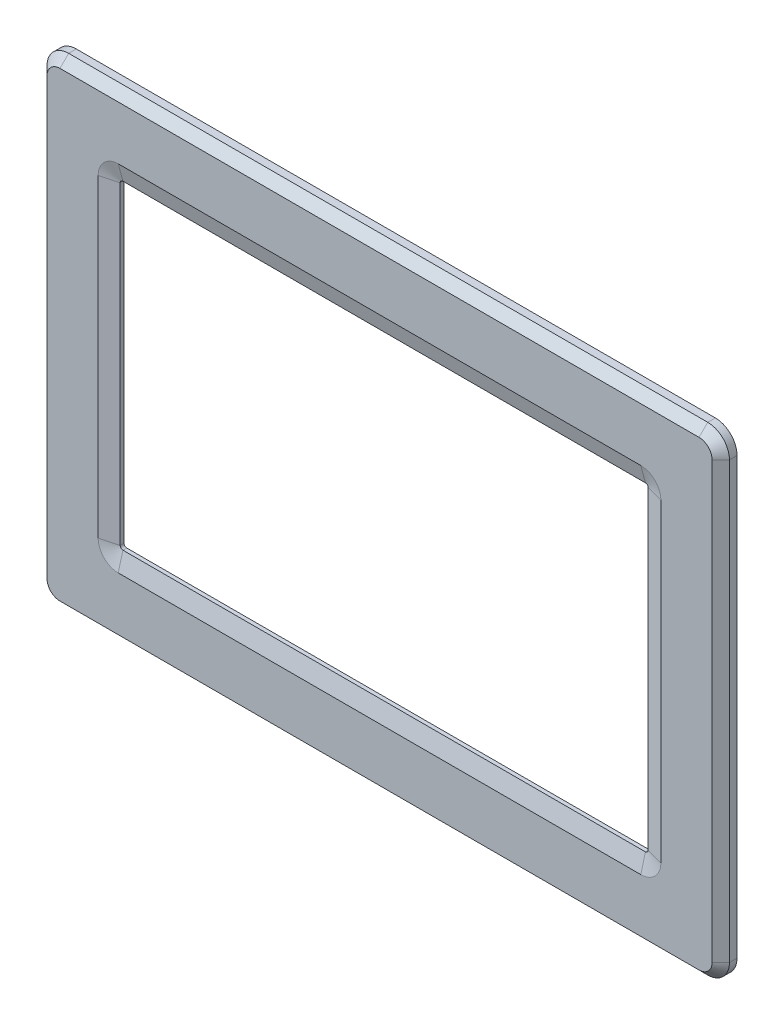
SolidWorks part; units mm, degrees
ref_plane "Front" through (0, 0, 0) normal (0, 0, 1) x (1, 0, 0)
ref_plane "Top" through (0, 0, 0) normal (0, 1, 0) x (1, 0, 0)
ref_plane "Right" through (0, 0, 0) normal (1, 0, 0) x (0, 0, -1)
sketch "Sketch1" plane through (0, 0, 0) normal (0, 0, 1) x (1, 0, 0)
  line L0 (0, 70.01) -> (0, -70.01) construction
  line L1 (-99.81, 70.01) -> (99.81, 70.01)
  line L2 (-99.81, 70.01) -> (-99.81, -70.01)
  line L3 (-99.81, -70.01) -> (99.81, -70.01)
  line L4 (99.81, 70.01) -> (99.81, -70.01)
  line L5 (83.3, -53.5) -> (83.3, 53.5) construction
  line L6 (83.3, 53.5) -> (-83.3, 53.5) construction
  dimension "D1" = 16.51
  dimension "D2" = 16.51
extrude "Extrude1" add sketch "Sketch1" along normal blind 4.7625
sketch "Sketch2" plane through (0, 0, 4.7625) normal (0, 0, 1) x (1, 0, 0)
  line L8 (77.216, -46.736) -> (77.216, 46.736)
  line L9 (-77.216, -46.736) -> (77.216, -46.736)
  line L10 (-77.216, 46.736) -> (-77.216, -46.736)
  line L11 (77.216, 46.736) -> (-77.216, 46.736)
  line L12 (77.216, -45.941) -> (77.216, 45.941)
  line L13 (-76.421, -46.736) -> (76.421, -46.736)
  line L14 (-77.216, 45.941) -> (-77.216, -45.941)
  line L15 (76.421, 46.736) -> (-76.421, 46.736)
  arc A0 (-76.421, 46.736) -> (-77.216, 45.941) centre (-76.421, 45.941) ccw
  arc A1 (77.216, 45.941) -> (76.421, 46.736) centre (76.421, 45.941) ccw
  arc A2 (76.421, -46.736) -> (77.216, -45.941) centre (76.421, -45.941) ccw
  arc A3 (-77.216, -45.941) -> (-76.421, -46.736) centre (-76.421, -45.941) ccw
  dimension "D2" = 0.795
  dimension "D1" = 1.016
extrude "Cut-Extrude1" cut sketch "Sketch2" against normal through all
sketch "Sketch3" plane through (0, 0, 0) normal (0, 0, -1) x (-1, 0, 0)
  line L8 (83.554, 53.754) -> (83.554, -53.5)
  line L9 (-83.554, 53.754) -> (83.554, 53.754)
  line L10 (-83.554, -53.754) -> (-83.554, 53.754)
  line L11 (22.9, -53.754) -> (-83.554, -53.754)
  line L12 (83.554, 53.754) -> (83.554, -53.754)
  line L13 (-83.554, 53.754) -> (83.554, 53.754)
  line L14 (-83.554, -53.754) -> (-83.554, 53.754)
  line L15 (83.554, -53.754) -> (-83.554, -53.754)
  dimension "D1" = 0.254
extrude "Cut-Extrude2" cut sketch "Sketch3" against normal blind 2.286
sketch "Sketch10" plane through (0, 0, 0) normal (0, 0, -1) x (-1, 0, 0)
  line L0 (81.649, 12.7) -> (81.649, -12.7)
  line L2 (84.824, 9.525) -> (84.824, -9.525)
  line L3 (0, 0) -> (81.649, 0) construction
  line L4 (83.554, -53.754) -> (83.554, 53.754) construction
  line L5 (0, 0) -> (0, -20.3255) construction
  line L6 (-84.824, 9.525) -> (-84.824, -9.525)
  line L7 (-81.649, 12.7) -> (-81.649, -12.7)
  arc A0 (81.649, 12.7) -> (84.824, 9.525) centre (81.649, 9.525) cw
  arc A1 (84.824, -9.525) -> (81.649, -12.7) centre (81.649, -9.525) cw
  arc A2 (-84.824, -9.525) -> (-81.649, -12.7) centre (-81.649, -9.525) ccw
  arc A3 (-81.649, 12.7) -> (-84.824, 9.525) centre (-81.649, 9.525) ccw
  dimension "D1" = 3.175
  dimension "D2" = 25.4
  dimension "D3" = 1.27
extrude "Extrude6" cut sketch "Sketch10" against normal up to surface (2.286 mm away)
sketch "Sketch9" plane through (0, 0, 0) normal (0, 0, -1) x (-1, 0, 0)
  line L0 (0, 0) -> (-21.889, 0) construction
  line L1 (0, 0) -> (0, 20.7425) construction
  line L2 (-83.554, 53.754) -> (-81.9665, 53.754)
  line L3 (83.554, 53.754) -> (-83.554, 53.754) construction
  line L4 (83.554, 53.754) -> (81.9665, 53.754)
  line L5 (83.554, -53.754) -> (81.9665, -53.754)
  line L6 (-83.554, -53.754) -> (-81.9665, -53.754)
  arc A0 (-81.9665, 53.754) -> (-83.554, 53.754) centre (-82.7603, 53.754) ccw
  arc A1 (81.9665, 53.754) -> (83.554, 53.754) centre (82.7603, 53.754) cw
  arc A2 (81.9665, -53.754) -> (83.554, -53.754) centre (82.7603, -53.754) ccw
  arc A3 (-81.9665, -53.754) -> (-83.554, -53.754) centre (-82.7603, -53.754) cw
  dimension "D1" = 1.5875
extrude "Extrude5" cut sketch "Sketch9" against normal up to surface (2.286 mm away)
chamfer "Chamfer1" distance 5.08 angle 15 8 edges at (0, -46.736, 4.7625) (76.9831, -46.5031, 4.7625) (-76.9831, -46.5031, 4.7625) (77.216, 0, 4.7625) (-77.216, 0, 4.7625) (76.9831, 46.5031, 4.7625) (-76.9831, 46.5031, 4.7625) (0, 46.736, 4.7625)
fillet "Fillet1" radius 6.35 4 edges at (-99.81, -70.01, 2.3813) (99.81, -70.01, 2.3813) (99.81, 70.01, 2.3813) (-99.81, 70.01, 2.3813)
chamfer "Chamfer2" distance 2.54 angle 45 8 edges at (0, -70.01, 4.7625) (97.9501, -68.1501, 4.7625) (-97.9501, -68.1501, 4.7625) (99.81, 0, 4.7625) (-99.81, 0, 4.7625) (97.9501, 68.1501, 4.7625) (-97.9501, 68.1501, 4.7625) (0, 70.01, 4.7625)
sketch "Sketch4" plane through (0, 0, 0) normal (0, 0, -1) x (-1, 0, 0)
  line L12 (98.0574, -63.373) -> (98.0574, 63.373)
  line L13 (93.173, 68.2574) -> (-93.173, 68.2574)
  line L14 (-98.0574, 63.373) -> (-98.0574, -63.373)
  line L15 (-93.173, -68.2574) -> (93.173, -68.2574)
  line L16 (93.968, -63.66) -> (93.968, 63.66)
  line L17 (-93.46, -64.168) -> (93.46, -64.168)
  line L18 (-93.968, 63.66) -> (-93.968, -63.66)
  line L19 (93.46, 64.168) -> (-93.46, 64.168)
  line L20 (93.968, -63.373) -> (93.968, 63.373)
  line L21 (-93.173, -64.168) -> (93.173, -64.168)
  line L22 (-93.968, 63.373) -> (-93.968, -63.373)
  line L23 (93.173, 64.168) -> (-93.173, 64.168)
  arc A8 (-93.173, 64.168) -> (-93.968, 63.373) centre (-93.173, 63.373) ccw
  arc A9 (93.968, 63.373) -> (93.173, 64.168) centre (93.173, 63.373) ccw
  arc A10 (93.173, -64.168) -> (93.968, -63.373) centre (93.173, -63.373) ccw
  arc A11 (-93.968, -63.373) -> (-93.173, -64.168) centre (-93.173, -63.373) ccw
  arc A12 (98.0574, 63.373) -> (93.173, 68.2574) centre (93.173, 63.373) ccw
  arc A13 (-93.173, 68.2574) -> (-98.0574, 63.373) centre (-93.173, 63.373) ccw
  arc A14 (-98.0574, -63.373) -> (-93.173, -68.2574) centre (-93.173, -63.373) ccw
  arc A15 (93.173, -68.2574) -> (98.0574, -63.373) centre (93.173, -63.373) ccw
  arc A20 (-93.968, -63.66) -> (-93.46, -64.168) centre (-93.46, -63.66) ccw
  arc A22 (-93.46, 64.168) -> (-93.968, 63.66) centre (-93.46, 63.66) ccw
  arc A24 (93.968, 63.66) -> (93.46, 64.168) centre (93.46, 63.66) ccw
  arc A26 (93.46, -64.168) -> (93.968, -63.66) centre (93.46, -63.66) ccw
  dimension "D1" = 5.842
  dimension "D3" = 4.0894
extrude "Extrude2" cut sketch "Sketch4" against normal blind 0.762
sketch "Sketch5" plane through (0, 0, 0) normal (0, 0, -1) x (-1, 0, 0)
  line L6 (83.058, 55.532) -> (83.058, 59.596)
  line L7 (-83.058, 59.596) -> (-83.058, 55.532)
  line L8 (79.629, 63.025) -> (-79.629, 63.025)
  line L9 (83.058, 54.4525) -> (83.058, 59.596)
  line L10 (-83.058, 59.596) -> (-83.058, 54.4525)
  line L11 (79.629, 63.025) -> (-79.629, 63.025)
  line L13 (81.4705, 52.865) -> (-81.4705, 52.865)
  line L14 (0, 0) -> (-18.1366, 0) construction
  line L15 (81.4705, -52.865) -> (-81.4705, -52.865)
  line L16 (79.629, -63.025) -> (-79.629, -63.025)
  line L17 (-83.058, -59.596) -> (-83.058, -54.4525)
  line L18 (83.058, -54.4525) -> (83.058, -59.596)
  arc A4 (83.058, 59.596) -> (79.629, 63.025) centre (79.629, 59.596) ccw
  arc A5 (-79.629, 63.025) -> (-83.058, 59.596) centre (-79.629, 59.596) ccw
  arc A6 (83.058, 59.596) -> (79.629, 63.025) centre (79.629, 59.596) ccw
  arc A7 (-79.629, 63.025) -> (-83.058, 59.596) centre (-79.629, 59.596) ccw
  arc A8 (-83.058, 54.4525) -> (-81.4705, 52.865) centre (-81.4705, 54.4525) ccw
  arc A9 (83.058, 54.4525) -> (81.4705, 52.865) centre (81.4705, 54.4525) cw
  arc A10 (83.058, -54.4525) -> (81.4705, -52.865) centre (81.4705, -54.4525) ccw
  arc A11 (-83.058, -54.4525) -> (-81.4705, -52.865) centre (-81.4705, -54.4525) cw
  arc A12 (-79.629, -63.025) -> (-83.058, -59.596) centre (-79.629, -59.596) cw
  arc A13 (83.058, -59.596) -> (79.629, -63.025) centre (79.629, -59.596) cw
  dimension "D2" = 1.5875
  dimension "D3" = 10.16
  dimension "D1" = 0.254
extrude "Extrude3" cut sketch "Sketch5" against normal blind 1.016
hole_wizard "#2-56 Tapped Hole1" positions "Sketch7" profile "Sketch6" tap size "#2-56" standard "Ansi Inch"
sketch "Sketch7" plane through (0, 0, 1.016) normal (0, 0, -1) x (-1, 0, 0)
  point P3 (-75.4416, 59.596)
  point P9 (0, 59.596)
  point P15 (75.4416, 59.596)
  point P18 (75.4416, -59.596)
  point P24 (0, -59.596)
  point P30 (-75.4416, -59.596)
sketch "Sketch6" plane through (75.4416, 59.596, 1.016) normal (1, 0, 0) x (0, 1, 0)
  line L0 (0, 0) -> (0, 3.302)
  line L1 (0, 3.302) -> (0.889, 3.302)
  line L2 (0.889, 3.302) -> (0.889, 0)
  line L5 (0.889, 0) -> (0, 0)
  line L10 (0, 3.302) -> (-0.889, 3.302) construction
  line L11 (0, -6.35) -> (0, 107.95) construction
  dimension "Tap Drill Dia." = 1.778
  dimension "Tap Drill Depth" = 3.302
  dimension "Drill Angle" = 180
sketch "Sketch8" plane through (0, 0, 2.286) normal (0, 0, -1) x (-1, 0, 0)
  line L9 (76.421, 51.689) -> (-76.421, 51.689)
  line L10 (-82.169, 45.941) -> (-82.169, -45.941)
  line L11 (-76.421, -51.689) -> (76.421, -51.689)
  line L12 (82.169, -45.941) -> (82.169, 45.941)
  line L13 (76.421, 48.387) -> (-76.421, 48.387)
  line L14 (78.867, -45.941) -> (78.867, 45.941)
  line L15 (-76.421, -48.387) -> (76.421, -48.387)
  line L16 (-78.867, 45.941) -> (-78.867, -45.941)
  line L17 (76.421, 48.387) -> (-76.421, 48.387)
  line L18 (78.867, -45.941) -> (78.867, 45.941)
  line L19 (-76.421, -48.387) -> (76.421, -48.387)
  line L20 (-78.867, 45.941) -> (-78.867, -45.941)
  arc A4 (-76.421, 51.689) -> (-82.169, 45.941) centre (-76.421, 45.941) ccw
  arc A5 (-82.169, -45.941) -> (-76.421, -51.689) centre (-76.421, -45.941) ccw
  arc A6 (76.421, -51.689) -> (82.169, -45.941) centre (76.421, -45.941) ccw
  arc A7 (82.169, 45.941) -> (76.421, 51.689) centre (76.421, 45.941) ccw
  arc A8 (78.867, 45.941) -> (76.421, 48.387) centre (76.421, 45.941) ccw
  arc A9 (76.421, -48.387) -> (78.867, -45.941) centre (76.421, -45.941) ccw
  arc A10 (-78.867, -45.941) -> (-76.421, -48.387) centre (-76.421, -45.941) ccw
  arc A11 (-76.421, 48.387) -> (-78.867, 45.941) centre (-76.421, 45.941) ccw
  arc A12 (78.867, 45.941) -> (76.421, 48.387) centre (76.421, 45.941) ccw
  arc A13 (76.421, -48.387) -> (78.867, -45.941) centre (76.421, -45.941) ccw
  arc A14 (-78.867, -45.941) -> (-76.421, -48.387) centre (-76.421, -45.941) ccw
  arc A15 (-76.421, 48.387) -> (-78.867, 45.941) centre (-76.421, 45.941) ccw
  dimension "D1" = 1.651
  dimension "D2" = 3.302
extrude "Extrude4" cut sketch "Sketch8" against normal blind 1.016
sketch "Sketch11" plane through (0, 0, 1.016) normal (0, 0, -1) x (-1, 0, 0)
  line L0 (0, 0) -> (0, 22.5074) construction
  line L1 (0, 0) -> (-19.0069, 0) construction
  line L2 (-75.4416, 59.596) -> (-62.7416, 59.596) construction
  circle A0 centre (-62.7416, 59.596) radius 2.1844
  circle A1 centre (62.7416, 59.596) radius 2.1844
  circle A2 centre (62.7416, -59.596) radius 2.1844
  circle A3 centre (-62.7416, -59.596) radius 2.1844
  dimension "D1" = 4.3688
  dimension "D2" = 12.7
extrude "Extrude7" cut sketch "Sketch11" against normal blind 2.032
